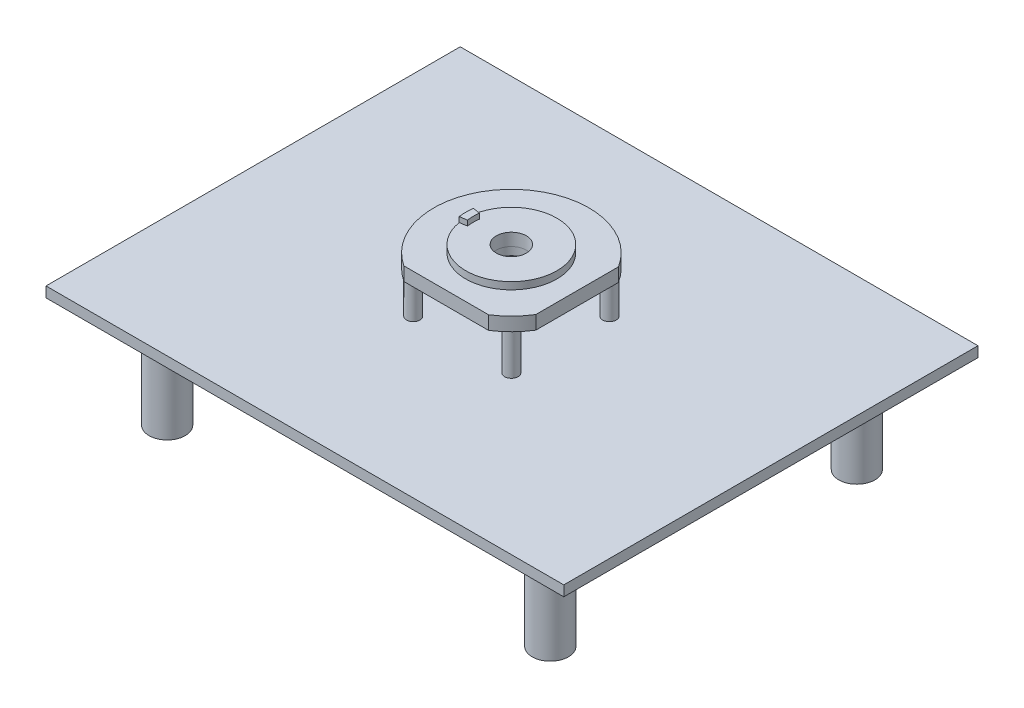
SolidWorks part; units mm, degrees
ref_plane "Front Plane" through (0, 0, 0) normal (0, 0, 1) x (1, 0, 0)
ref_plane "Top Plane" through (0, 0, 0) normal (0, 1, 0) x (1, 0, 0)
ref_plane "Right Plane" through (0, 0, 0) normal (1, 0, 0) x (0, 0, -1)
imported_body "Imported1"
sketch "Sketch1" plane through (0, 58, 0) normal (0, 1, 0) x (1, 0, 0)
  line L0 (0, 0) -> (0, -161.0277) construction
  line L1 (-50.8, -63.5) -> (50.8, -63.5)
  line L2 (-50.8, -63.5) -> (-50.8, -114.3)
  line L3 (-50.8, -114.3) -> (50.8, -114.3)
  line L4 (50.8, -63.5) -> (50.8, -114.3)
  line L5 (63.5, 50.8) -> (114.3, 50.8)
  line L6 (63.5, 50.8) -> (63.5, -50.8)
  line L7 (63.5, -50.8) -> (114.3, -50.8)
  line L8 (114.3, 50.8) -> (114.3, -50.8)
  line L9 (0, 0) -> (180.4667, 0) construction
  dimension "D1" = 63.5
  dimension "D2" = 50.8
  dimension "D3" = 101.6
  dimension "D4" = 63.5
  dimension "D5" = 101.6
  dimension "D6" = 50.8
extrude "Cut-Extrude1" cut sketch "Sketch1" against normal up to surface (8 mm away)
ref_plane "Plane1" through (0, 0, -22.25) normal (0, 0, 1) x (1, 0, 0)
sketch "S1" plane through (0, 0, -22.25) normal (0, 0, 1) x (1, 0, 0)
  spline S0 degree 3 poles (298.2591, 203.7688) (320.2, 166.4355) (313.8316, 89.4326) (289.6268, 15.5747) (308.8654, -18.6178) knots 0 0 0 0 0.534702 1 1 1 1
sketch "Sketch2" plane through (0, 10, 0) normal (0, 1, 0) x (1, 0, 0)
  line L0 (0, 0) -> (0, -0.6238)
  point P0 (0, -0.6238)
  point P1 (0, 0)
other "Move Face2" parameters "D1"=0.6238
other "Move Face3" parameters "D1"=5.08
